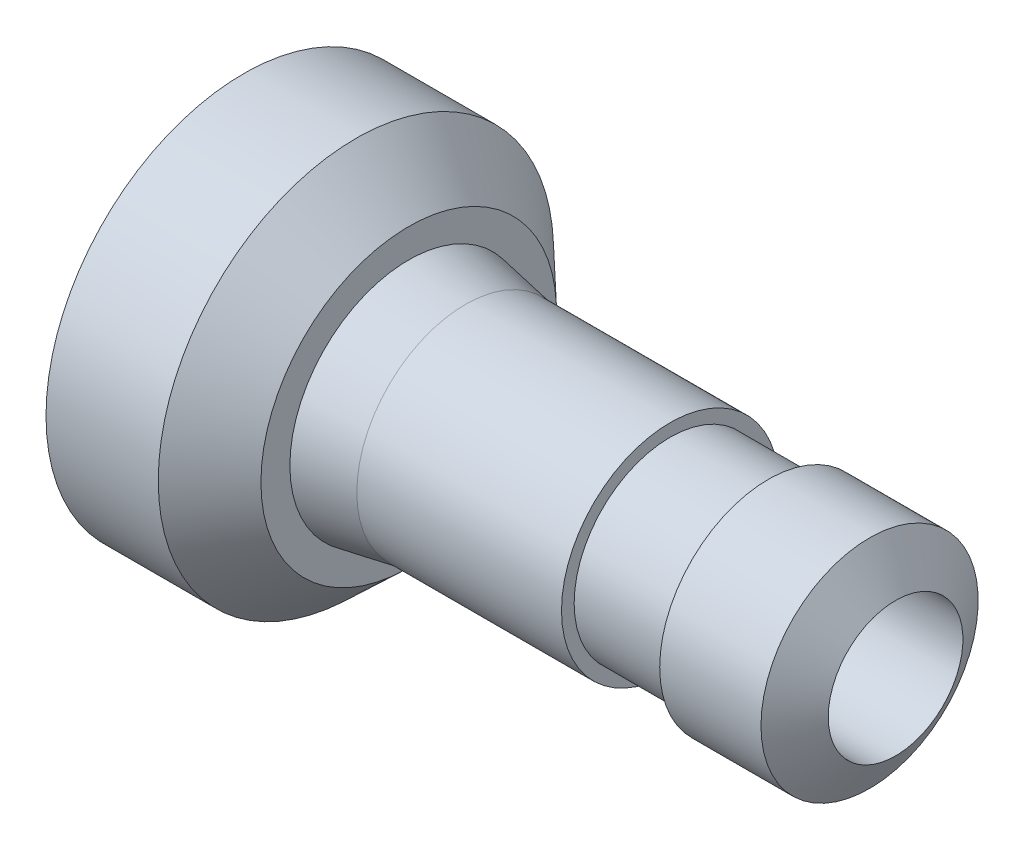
SolidWorks part; units mm, degrees
ref_plane "Front Plane" through (0, 0, 0) normal (0, 0, 1) x (1, 0, 0)
ref_plane "Top Plane" through (0, 0, 0) normal (0, 1, 0) x (1, 0, 0)
ref_plane "Right Plane" through (0, 0, 0) normal (1, 0, 0) x (0, 0, -1)
sketch "Sketch1" plane through (0, 0, 0) normal (0, 0, 1) x (1, 0, 0)
  line L0 (0, 0) -> (0, 15.8771)
  line L1 (0, 53.1536) -> (0, 71.1018)
  line L2 (0, 71.1018) -> (40.383, 71.1018)
  line L3 (40.383, 71.1018) -> (59.3664, 53.1538)
  line L4 (59.3664, 53.1538) -> (59.3664, 42.744)
  line L5 (59.3664, 42.744) -> (79.7564, 39.0653)
  line L6 (79.7564, 39.0653) -> (153.3941, 39.0653)
  line L7 (153.3941, 39.0653) -> (153.3941, 34.5153)
  line L8 (153.3941, 34.5153) -> (188.7245, 34.5153)
  line L9 (188.7245, 34.5153) -> (188.7245, 39.0653)
  line L10 (188.7245, 39.0653) -> (225.1478, 39.0653)
  line L11 (225.1478, 39.0653) -> (234.5012, 24.219)
  line L12 (234.5012, 24.219) -> (219.1088, 7.9385)
  line L13 (219.1088, 7.9385) -> (234.5012, 0)
  line L14 (0, 0) -> (234.5012, 0)
  arc A0 (0, 15.8771) -> (0, 53.1536) centre (0, 34.5153) ccw
revolve "Revolve1" add sketch "Sketch1" angle 360 about L14
other "DeleteFace1"
ref_plane "Plane1" through (236.22, 0, 0) normal (1, 0, 0) x (0, 0, -1)
sketch "Sketch2" plane through (236.22, 0, 0) normal (1, 0, 0) x (0, 0, -1)
  circle A0 centre (0, 0) radius 24.219 construction
  circle A1 centre (0, 0) radius 24.219
extrude "Extrude1" cut sketch "Sketch2" against normal through all
